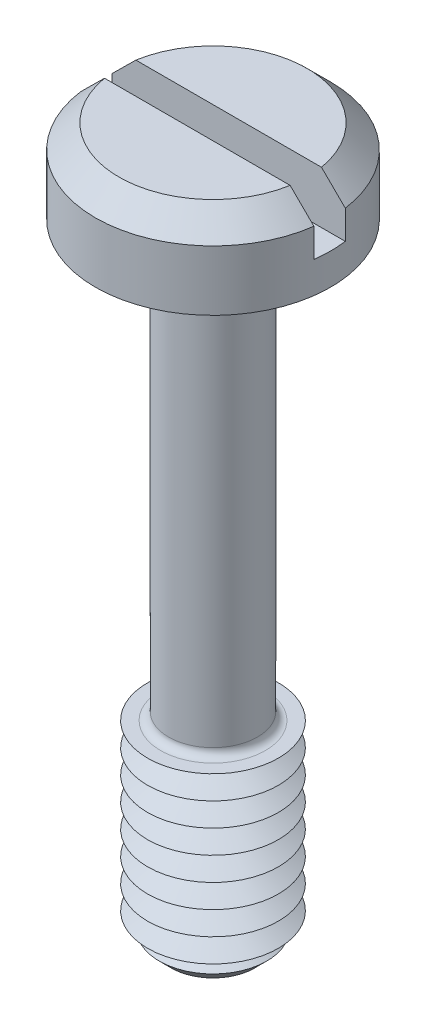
SolidWorks part; units mm, degrees
ref_plane "Front Plane" through (0, 0, 0) normal (0, 0, 1) x (1, 0, 0)
ref_plane "Top Plane" through (0, 0, 0) normal (0, 1, 0) x (1, 0, 0)
ref_plane "Right Plane" through (0, 0, 0) normal (1, 0, 0) x (0, 0, -1)
sketch "Sketch1" plane through (0, 0, 0) normal (0, 1, 0) x (1, 0, 0)
  circle A0 centre (0, 0) radius 2.25
  dimension "D1" = 4.5
extrude "Boss-Extrude1" add sketch "Sketch1" along normal blind 1.6
sketch "Sketch2" plane through (0, 0, 0) normal (0, -1, 0) x (1, 0, 0)
  circle A0 centre (0, 0) radius 0.85
  dimension "D1" = 1.7
extrude "Boss-Extrude2" add sketch "Sketch2" along normal blind 12
sketch "Sketch3" plane through (0, -12, 0) normal (0, -1, 0) x (1, 0, 0)
  circle A0 centre (0, 0) radius 1.25
  dimension "D1" = 2.5
extrude "Boss-Extrude3" add sketch "Sketch3" against normal blind 3.7
chamfer "Chamfer1" distance 0.45 angle 45 1 edges at (0, -12, -1.25)
sketch "Sketch4" plane through (0, 0, 0) normal (1, 0, 0) x (0, 0, -1)
  line L0 (0, -6.5871) -> (0, -12.0372) construction
sketch "Sketch5" plane through (0, 0, 0) normal (1, 0, 0) x (0, 0, -1)
  line L0 (-1.25, -8.3) -> (-0.8603, -8.525)
  line L1 (-0.8603, -8.525) -> (-1.25, -8.75)
  line L2 (-1.25, -8.3) -> (-1.25, -11.55) construction
  line L3 (-1.25, -8.75) -> (-1.25, -8.3)
  dimension "D1" = 0.45
revolve "Cut-Revolve1" cut sketch "Sketch5" angle 360 about L0
pattern_linear "LPattern1" count 8 spacing 0.45 along (0, -1, 0) of "Cut-Revolve1"
fillet "Fillet1" radius 0.15 2 edges at (0, -8.3, -0.85) (0, 0, -0.85)
chamfer "Chamfer2" distance 0.45 angle 45 1 edges at (0, 1.6, 2.25)
sketch "Sketch6" plane through (0, 1.6, 0) normal (0, 1, 0) x (1, 0, 0)
  line L1 (2.25, -0.3) -> (-2.25, -0.3)
  line L2 (2.25, -0.3) -> (2.25, 0.3)
  line L3 (2.25, 0.3) -> (-2.25, 0.3)
  line L4 (-2.25, -0.3) -> (-2.25, 0.3)
  line L5 (2.25, -0.3) -> (-2.25, 0.3) construction
  line L6 (2.25, 0.3) -> (-2.25, -0.3) construction
  circle A0 centre (0, 0) radius 2.25 construction
  point P0 (0, 0)
  dimension "D1" = 0.6
extrude "Cut-Extrude1" cut sketch "Sketch6" against normal blind 1
